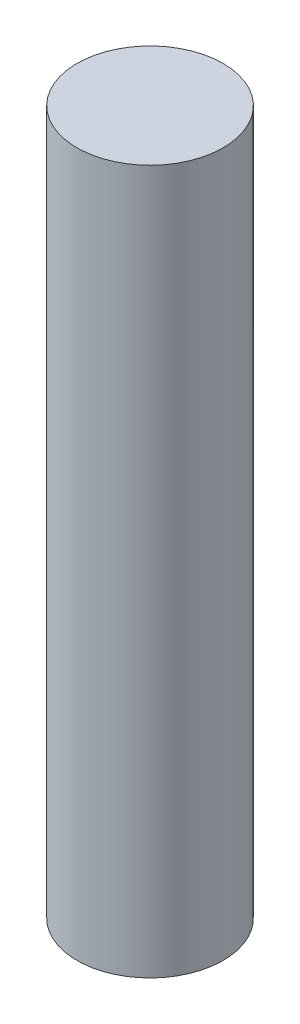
SolidWorks part; units mm, degrees
ref_plane "Piano frontale" through (0, 0, 0) normal (0, 0, 1) x (1, 0, 0)
ref_plane "Piano superiore" through (0, 0, 0) normal (0, 1, 0) x (1, 0, 0)
ref_plane "Piano destro" through (0, 0, 0) normal (1, 0, 0) x (0, 0, -1)
sketch "Schizzo1" plane through (0, 0, 0) normal (0, 1, 0) x (1, 0, 0)
  circle A0 centre (0, 0) radius 1.35
  dimension "D1" = 2.7
extrude "Estrusione-Estrusione1" add sketch "Schizzo1" along normal blind 13
